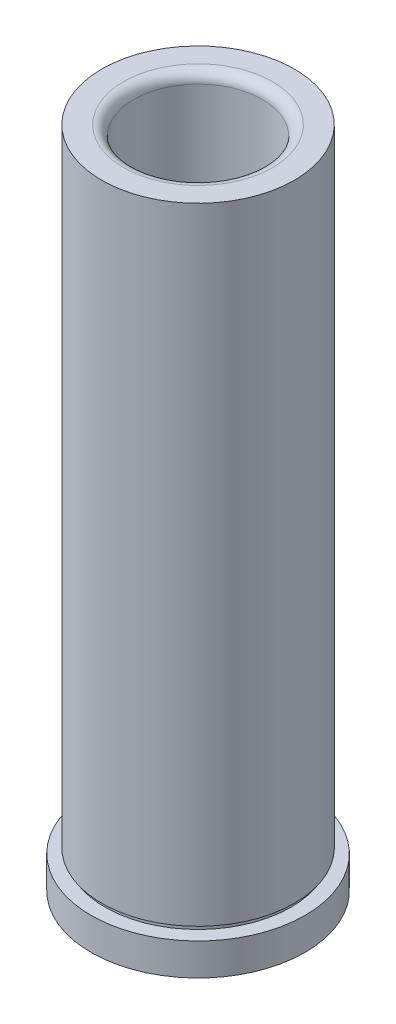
SolidWorks part; units mm, degrees
ref_plane "Front Plane" through (0, 0, 0) normal (0, 0, 1) x (1, 0, 0)
ref_plane "Top Plane" through (0, 0, 0) normal (0, 1, 0) x (1, 0, 0)
ref_plane "Right Plane" through (0, 0, 0) normal (1, 0, 0) x (0, 0, -1)
sketch "Sketch1" plane through (0, 0, 0) normal (0, 0, 1) x (1, 0, 0)
  line L0 (-702.8011, 0) -> (49297.1989, 0) construction
  line L1 (0, -1000) -> (0, 49000) construction
  line L2 (-9.5313, 98.425) -> (-9.5313, 60.325)
  line L3 (-11.5951, 0) -> (-15.875, 0)
  line L4 (-15.875, 0) -> (-15.875, 4.7625)
  line L5 (-15.875, 4.7625) -> (-13.7858, 4.7625)
  line L6 (-14.2939, 98.425) -> (-14.2938, 5.5245)
  line L7 (-14.2939, 98.425) -> (-9.5313, 98.425)
  line L8 (-10.8013, 59.055) -> (-10.8013, 0.7938)
  line L10 (-14.2938, 5.5245) -> (-13.7858, 5.5245)
  line L11 (-13.7858, 5.5245) -> (-13.7858, 4.7625)
  line L12 (-10.8013, 0.7938) -> (-11.5951, 0)
  arc A0 (-9.5313, 60.325) -> (-10.8013, 59.055) centre (-9.5313, 59.055) ccw
  dimension "D1" = 0.508
  dimension "OD" = 28.5877
  dimension "ID" = 19.0627
  dimension "FLANGETHICKNESS" = 4.7625
  dimension "FLANGEDIA" = 31.75
  dimension "D2" = 1.27
  dimension "D3" = 0.762
  dimension "OVERALL LENGTH" = 98.425
  dimension "D4" = 45
  dimension "D5" = 0.7937
  dimension "D6" = 38.1
revolve "Revolve1" add sketch "Sketch1" angle 360 about L1
fillet "Fillet1" radius 1.524 1 edges at (9.5313, 98.425, 0)
